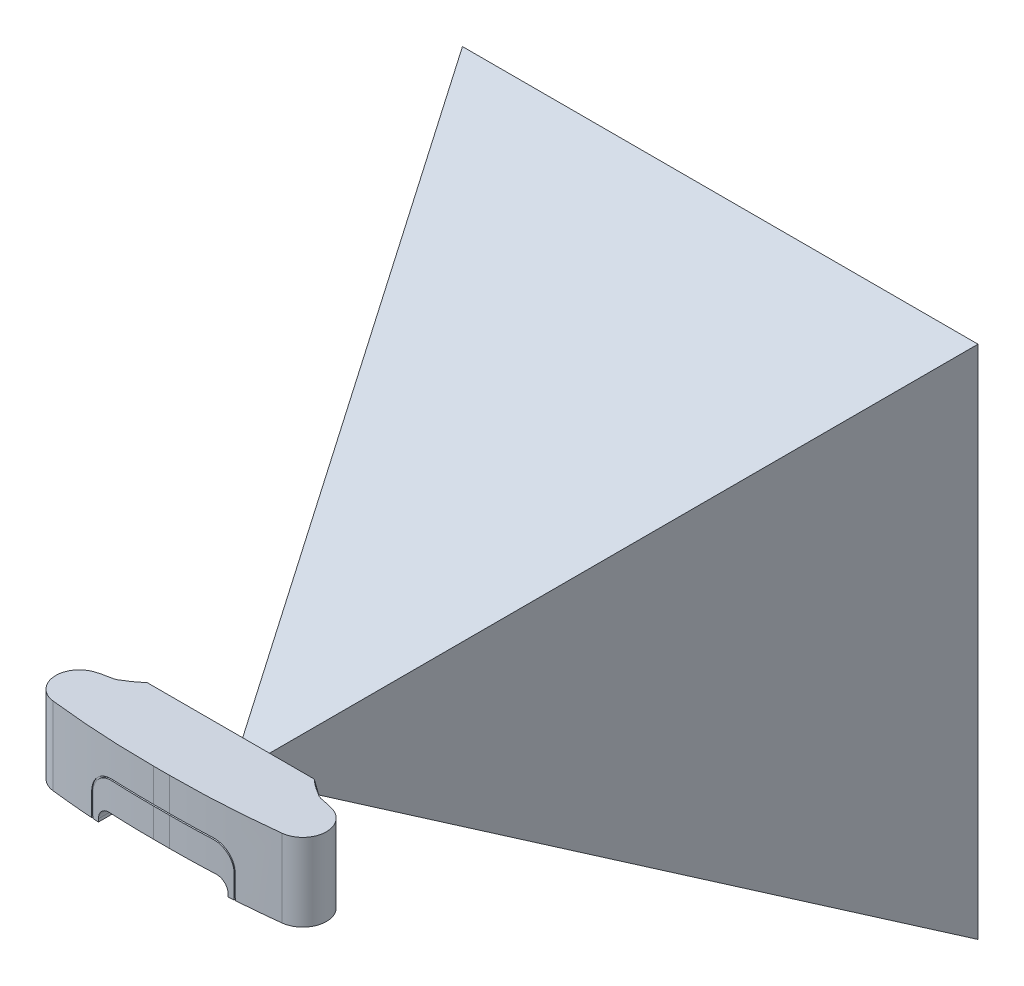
SolidWorks part; units mm, degrees
ref_plane "Ön Düzlem" through (0, 0, 0) normal (0, 0, 1) x (1, 0, 0)
ref_plane "Üst Düzlem" through (0, 0, 0) normal (0, 1, 0) x (1, 0, 0)
ref_plane "Sağ Düzlem" through (0, 0, 0) normal (1, 0, 0) x (0, 0, -1)
sketch "Çizim1" plane through (0, 0, 0) normal (0, 0, 1) x (1, 0, 0)
  line L1 (0, 0) -> (50, 0)
  line L2 (0, 0) -> (0, 27)
  line L3 (0, 27) -> (50, 27)
  line L4 (50, 0) -> (50, 27)
  dimension "D1" = 27
  dimension "D2" = 50
extrude "Yükseklik-Ekstrüzyon1" add sketch "Çizim1" along normal blind 24
sketch "Çizim3" plane through (0, 27, 0) normal (0, 1, 0) x (1, 0, 0)
  line L1 (18, 0) -> (0, 0)
  line L2 (50, 0) -> (0, 0) construction
  line L3 (0, 0) -> (0, -24)
  line L6 (4.4963, -21.1537) -> (25, -24)
  line L7 (50, -24) -> (0, -24) construction
  line L8 (0, -24) -> (25, -24)
  spline S0 degree 3 poles (18, 0) (16.5757, -5.0723) (9.6487, -3.9906) (-2.6783, -12.0274) (1.7043, -20.166) (4.4963, -21.1537) knots 0 0 0 0 0.297894 0.743933 1 1 1 1
  dimension "D1" = 5
  dimension "D2" = 18
extrude "Kes-Ekstrüzyon3" cut sketch "Çizim3" against normal blind 42
fillet "Radyus1" radius 322 1 edges at (25, 13.5, 24)
fillet "Radyus2" radius 8.2 1 edges at (4.4963, 13.5, 21.1537)
mirror "Aynalama2" of "Radyus1", "Radyus2", "Kes-Ekstrüzyon3", "Yükseklik-Ekstrüzyon1"
sketch "Çizim4" plane through (0, 0, 0) normal (0, 0, -1) x (-1, 0, 0)
  line L0 (-50, 27) -> (-50, 0) construction
  line L1 (-82, 27) -> (-18, 27) construction
  line L2 (-18, 0) -> (-82, 0) construction
  line L3 (-18, 13.5) -> (-82, 13.5) construction
  line L4 (-18, 27) -> (-18, 0) construction
  line L5 (-82, 0) -> (-82, 27) construction
  circle A0 centre (-50, 13.5) radius 32
sketch3d "3B Çizim1"
  line L0 (82, 27, 0) -> (18, 27, 0) construction
  line L1 (20.9871, 27, 0) -> (18, 27, 0)
  line L2 (18, 27, 0) -> (14.0372, 27, 4.6656)
  circle A0 centre (50, 13.5, 0) radius 32 construction
  spline S0 degree 2 poles (20.9871, 27, 0) (17.8483, 27, 2.8761) (14.0372, 27, 4.6656) knots 0 0 0 1 1 1
  spline S1 degree 3 poles (8.2283, 27, 6.0872) (9.045, 27, 5.7688) (13.0938, 27, 4.5286) (16.5757, 27, 5.0723) (18, 27, 0) knots 0 0 0 0 0.203368 1 1 1 1 construction
  point P8 (50, 13.5, -32)
sweep "Kes-Süpür1" cut profiles "3B Çizim1" path "Çizim4"
sketch "Çizim5" plane through (0, 0, 0) normal (0, 0, -1) x (-1, 0, 0)
  line L0 (-50, 27) -> (-50, 0) construction
  line L1 (-79.0129, 27) -> (-20.9871, 27) construction
  line L2 (-20.9871, 0) -> (-79.0129, 0) construction
  line L3 (-82, 13.5) -> (-18, 13.5) construction
  line L4 (-78.0401, 25.5) -> (-21.9599, 25.5)
  line L5 (-21.9599, 1.5) -> (-78.0401, 1.5)
  arc A0 (-78.0401, 25.5) -> (-78.0401, 1.5) centre (-50, 13.5) ccw
  arc A1 (-21.9599, 1.5) -> (-21.9599, 25.5) centre (-50, 13.5) ccw
  dimension "D1" = 61
  dimension "D2" = 1.5
  dimension "D3" = 1.5
extrude "Kes-Ekstrüzyon4" cut sketch "Çizim5" against normal blind 1
sketch "Çizim6" plane through (0, 0, 1) normal (0, 0, -1) x (-1, 0, 0)
  line L0 (-50, 25.5) -> (-50, 1.5) construction
  line L1 (-21.9599, 25.5) -> (-78.0401, 25.5) construction
  line L2 (-78.0401, 1.5) -> (-21.9599, 1.5) construction
  line L3 (-19.5, 13.5) -> (-80.5, 13.5) construction
  line L4 (-60.583, 25.5) -> (-59.8107, 25.5)
  line L5 (-21.9599, 25.5) -> (-78.0401, 25.5) construction
  line L6 (-40.1893, 25.5) -> (-39.417, 25.5)
  line L7 (-39.417, 1.5) -> (-40.1893, 1.5)
  line L8 (-78.0401, 1.5) -> (-21.9599, 1.5) construction
  line L9 (-60.583, 1.5) -> (-59.8107, 1.5)
  arc A0 (-78.0401, 25.5) -> (-78.0401, 1.5) centre (-50, 13.5) ccw construction
  arc A1 (-21.9599, 1.5) -> (-21.9599, 25.5) centre (-50, 13.5) ccw construction
  arc A2 (-39.417, 1.5) -> (-39.417, 25.5) centre (-50, 13.5) ccw
  arc A3 (-40.1893, 1.5) -> (-40.1893, 25.5) centre (-50, 13.5) ccw
  arc A4 (-60.583, 25.5) -> (-60.583, 1.5) centre (-50, 13.5) ccw
  arc A5 (-59.8107, 25.5) -> (-59.8107, 1.5) centre (-50, 13.5) ccw
  circle A6 centre (-50, 13.5) radius 9.5
  dimension "D1" = 32
  dimension "D2" = 31
  dimension "D3" = 19
extrude "Kes-Ekstrüzyon5" cut sketch "Çizim6" against normal blind 1
sketch "Çizim7" plane through (0, 0, 2) normal (0, 0, -1) x (-1, 0, 0)
  line L0 (-50, 25.5) -> (-50, 1.5) construction
  line L1 (-21.9599, 25.5) -> (-78.0401, 25.5) construction
  line L2 (-59.8107, 1.5) -> (-40.1893, 1.5) construction
  circle A0 centre (-50, 13.5) radius 8.5
  dimension "D1" = 17
extrude "Kes-Ekstrüzyon6" cut sketch "Çizim7" against normal blind 0.25
sketch "Çizim8" plane through (0, 0, 2.25) normal (0, 0, -1) x (-1, 0, 0)
  line L0 (-50, 25.5) -> (-50, 1.5) construction
  line L1 (-40.1893, 25.5) -> (-59.8107, 25.5) construction
  line L2 (-78.0401, 1.5) -> (-21.9599, 1.5) construction
  circle A0 centre (-50, 13.5) radius 7.5
  dimension "D1" = 15
extrude "Kes-Ekstrüzyon7" cut sketch "Çizim8" against normal blind 0.25
sketch "Çizim9" plane through (0, 0, 2.5) normal (0, 0, -1) x (-1, 0, 0)
  line L0 (-50, 25.5) -> (-50, 1.5) construction
  line L1 (-21.9599, 25.5) -> (-78.0401, 25.5) construction
  line L2 (-59.8107, 1.5) -> (-40.1893, 1.5) construction
  circle A0 centre (-50, 13.5) radius 6.5
  dimension "D1" = 13
extrude "Kes-Ekstrüzyon8" cut sketch "Çizim9" against normal blind 0.25
sketch "Çizim10" plane through (0, 0, 2.75) normal (0, 0, -1) x (-1, 0, 0)
  line L0 (-53.5707, 17) -> (-46.4293, 17)
  line L1 (-46.4293, 10) -> (-53.5707, 10)
  arc A0 (-53.5707, 17) -> (-53.5707, 10) centre (-50, 13.5) ccw
  arc A1 (-46.4293, 10) -> (-46.4293, 17) centre (-50, 13.5) ccw
  dimension "D1" = 10
  dimension "D2" = 7
extrude "Kes-Ekstrüzyon9" cut sketch "Çizim10" against normal blind 2
sketch "Çizim11" plane through (0, 0, 4.75) normal (0, 0, -1) x (-1, 0, 0)
  line L0 (-46.4293, 17) -> (-53.5707, 17) construction
  circle A0 centre (-50, 13.5) radius 3.5
extrude "Kes-Ekstrüzyon12" cut sketch "Çizim11" against normal blind 1 draft 56
sketch "Çizim12" plane through (0, 0, 24) normal (0, 0, 1) x (1, 0, 0)
  line L0 (25, 0) -> (25, 8)
  line L1 (10.2658, 0) -> (47.215, 0) construction
  line L2 (32.5, 15.5) -> (67.5, 15.5)
  line L3 (50, 27) -> (50, 15.5) construction
  line L5 (52.785, 27) -> (47.215, 27) construction
  line L6 (47.215, 0) -> (52.785, 0) construction
  line L7 (67.5, 15) -> (32.5, 15)
  line L8 (25.5, 8) -> (25.5, 0)
  line L9 (25.5, 0) -> (25, 0)
  line L12 (74.5, 0) -> (75, 0)
  line L13 (74.5, 8) -> (74.5, 0)
  line L14 (75, 0) -> (75, 8)
  line L15 (50, 15) -> (50, 0) construction
  arc A0 (25, 8) -> (32.5, 15.5) centre (32.5, 8) cw
  arc A1 (67.5, 15) -> (74.5, 8) centre (67.5, 8) cw
  arc A2 (75, 8) -> (67.5, 15.5) centre (67.5, 8) ccw
  arc A3 (32.5, 15) -> (25.5, 8) centre (32.5, 8) ccw
  dimension "D1" = 25
  dimension "D2" = 0.5
  dimension "D3" = 15
  dimension "D4" = 8
extrude "Kes-Ekstrüzyon13" cut sketch "Çizim12" against normal blind 1
sketch "Çizim13" plane through (0, 0, 24) normal (0, 0, 1) x (1, 0, 0)
  line L0 (27.5, 0) -> (27.5, 1)
  line L1 (25.5, 0) -> (47.215, 0) construction
  line L2 (31.5, 5) -> (68.5, 5)
  line L3 (72.5, 1) -> (72.5, 0)
  line L4 (52.785, 0) -> (74.5, 0) construction
  line L5 (72.5, 0) -> (27.5, 0)
  arc A0 (27.5, 1) -> (31.5, 5) centre (31.5, 1) cw
  arc A1 (68.5, 5) -> (72.5, 1) centre (68.5, 1) cw
  dimension "D4" = 4
  dimension "D1" = 2
  dimension "D2" = 5
  dimension "D3" = 2
extrude "Kes-Ekstrüzyon14" cut sketch "Çizim13" against normal blind 20
sketch "Çizim14" plane through (0, 0, 0) normal (0, -1, 0) x (1, 0, 0)
  line L0 (25.5, 23) -> (25, 23)
  line L1 (25, 23) -> (25, 3.5)
  line L2 (27, 1.5) -> (73, 1.5)
  line L3 (75, 3.5) -> (75, 23)
  line L4 (75, 23) -> (74.5, 23)
  line L5 (74.5, 23) -> (74.5, 3.5)
  line L6 (73, 2) -> (27, 2)
  line L7 (25.5, 3.5) -> (25.5, 23)
  line L8 (27.5, 4) -> (72.5, 4) construction
  arc A0 (25, 3.5) -> (27, 1.5) centre (27, 3.5) ccw
  arc A1 (73, 1.5) -> (75, 3.5) centre (73, 3.5) ccw
  arc A2 (74.5, 3.5) -> (73, 2) centre (73, 3.5) cw
  arc A3 (27, 2) -> (25.5, 3.5) centre (27, 3.5) cw
  dimension "D3" = 2
  dimension "D4" = 2
  dimension "D1" = 2
  dimension "D2" = 0.5
extrude "Kes-Ekstrüzyon15" cut sketch "Çizim14" against normal blind 0.5
sketch "Çizim15" plane through (0, 0, 4) normal (0, 0, 1) x (1, 0, 0)
  line L0 (50, 15) -> (50, 0) construction
  line L1 (47.215, 15) -> (52.785, 15) construction
  line L2 (50, 4) -> (50, 1) construction
  line L3 (50, 5) -> (50, 0) construction
  line L4 (39, 1) -> (61, 1)
  line L5 (39, 1) -> (39, 4)
  line L6 (39, 4) -> (61, 4)
  line L7 (61, 1) -> (61, 4)
  line L9 (68.5, 5) -> (31.5, 5) construction
  dimension "D1" = 22
  dimension "D2" = 3
  dimension "D3" = 1
extrude "Yükseklik-Ekstrüzyon2" add sketch "Çizim15" along normal blind 3
sketch "Çizim16" plane through (61, 0, 0) normal (1, 0, 0) x (0, 0, -1)
  line L0 (-7, 1) -> (-7, 4) construction
  circle A0 centre (-7, 2.5) radius 1.75
  dimension "D1" = 3.5
extrude "Yükseklik-Ekstrüzyon3" add sketch "Çizim16" against normal blind 22
sketch "Çizim17" plane through (61, 0, 0) normal (1, 0, 0) x (0, 0, -1)
  circle A0 centre (-7, 2.5) radius 1
  dimension "D1" = 2
extrude "Kes-Ekstrüzyon16" cut sketch "Çizim17" against normal blind 22
ref_plane "基准面1" through (0, 0, -170) normal (0, 0, -1) x (-1, 0, 0)
sketch "草图1" plane through (0, 0, -170) normal (0, 0, -1) x (-1, 0, 0)
  line L1 (-139.5, -76) -> (39.5, -76)
  line L2 (-139.5, -76) -> (-139.5, 103)
  line L3 (-139.5, 103) -> (39.5, 103)
  line L4 (39.5, -76) -> (39.5, 103)
  line L5 (-139.5, -76) -> (39.5, 103) construction
  line L6 (-139.5, 103) -> (39.5, -76) construction
  circle A0 centre (-50, 13.5) radius 2.0174 construction
  circle A1 centre (-50, 13.5) radius 2.0174 construction
  dimension "D1" = 179
  dimension "D2" = 179
sketch "草图3" plane through (0, 0, 0) normal (0, 0, -1) x (-1, 0, 0)
  point P0 (-50, 13.5)
loft "放样1" add profiles "草图3", "草图1"
